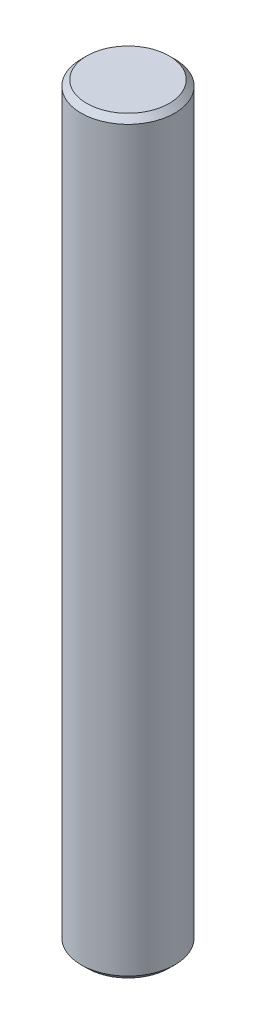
SolidWorks part; units mm, degrees
ref_plane "Front Plane" through (0, 0, 0) normal (0, 0, 1) x (1, 0, 0)
ref_plane "Top Plane" through (0, 0, 0) normal (0, 1, 0) x (1, 0, 0)
ref_plane "Right Plane" through (0, 0, 0) normal (1, 0, 0) x (0, 0, -1)
sketch "Sketch1" plane through (0, 0, 0) normal (0, 1, 0) x (1, 0, 0)
  circle A0 centre (0, 0) radius 6.3525
  dimension "D1" = 12.7051
extrude "Extrude1" add sketch "Sketch1" along normal mid plane 101.6
chamfer "Chamfer1" distance 0.762 angle 45 2 edges at (0, -50.8, 6.3525) (0, 50.8, 6.3525)
